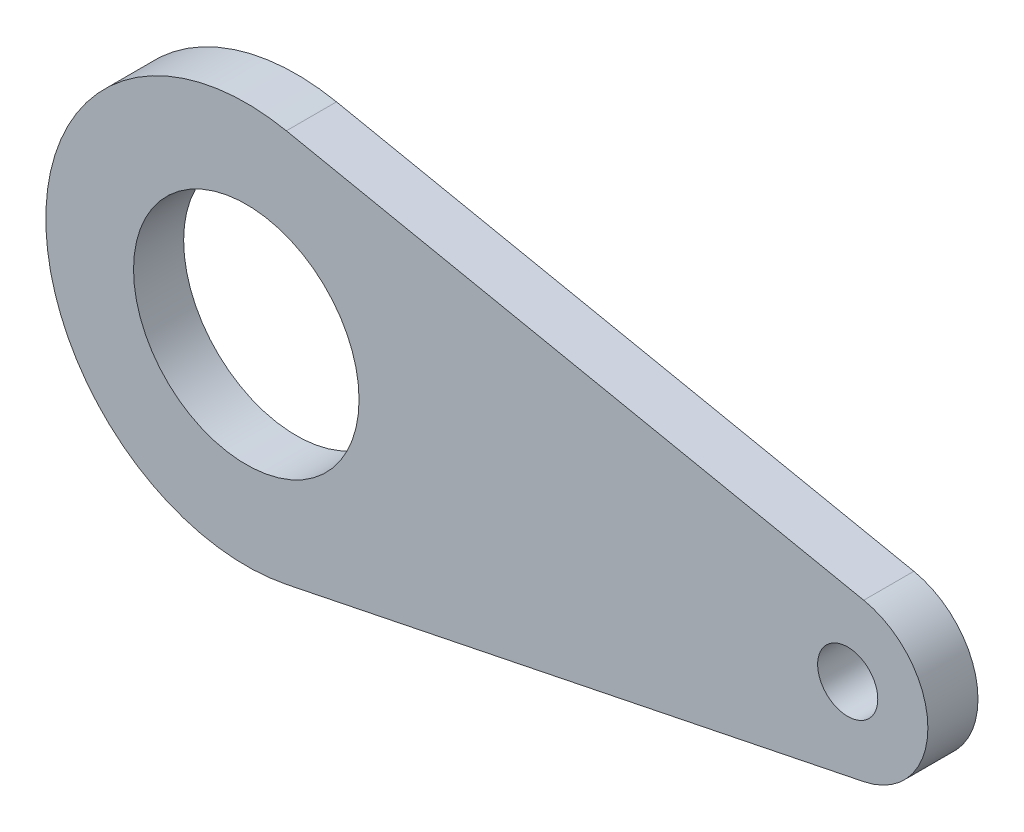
SolidWorks part; units mm, degrees
ref_plane "Plan1" through (0, 0, 0) normal (0, 0, 1) x (1, 0, 0)
ref_plane "Plan2" through (0, 0, 0) normal (0, 1, 0) x (1, 0, 0)
ref_plane "Plan3" through (0, 0, 0) normal (1, 0, 0) x (0, 0, -1)
sketch "Esquisse1" plane through (0, 0, 0) normal (0, 0, 1) x (1, 0, 0)
  line L0 (8, 39.1918) -> (123.2, 15.6767)
  line L1 (8, -39.1918) -> (123.2, -15.6767)
  arc A0 (8, 39.1918) -> (8, -39.1918) centre (0, 0) ccw
  arc A1 (123.2, -15.6767) -> (123.2, 15.6767) centre (120, 0) ccw
  circle A2 centre (120, 0) radius 6
  circle A3 centre (0, 0) radius 22.5
  dimension "D1" = 40
  dimension "D3" = 16
  dimension "D4" = 12
  dimension "D5" = 45
  dimension "D2" = 120
extrude "Base-Extrusion" add sketch "Esquisse1" along normal mid plane 10
sketch "Esquisse2" plane through (0, 0, 0) normal (0, 1, 0) x (1, 0, 0)
  line L0 (120, -10.6058) -> (120, 65) construction
  line L1 (120, -5) -> (120, 5) construction
  point P0 (120, 30)
  dimension "D1" = 30
